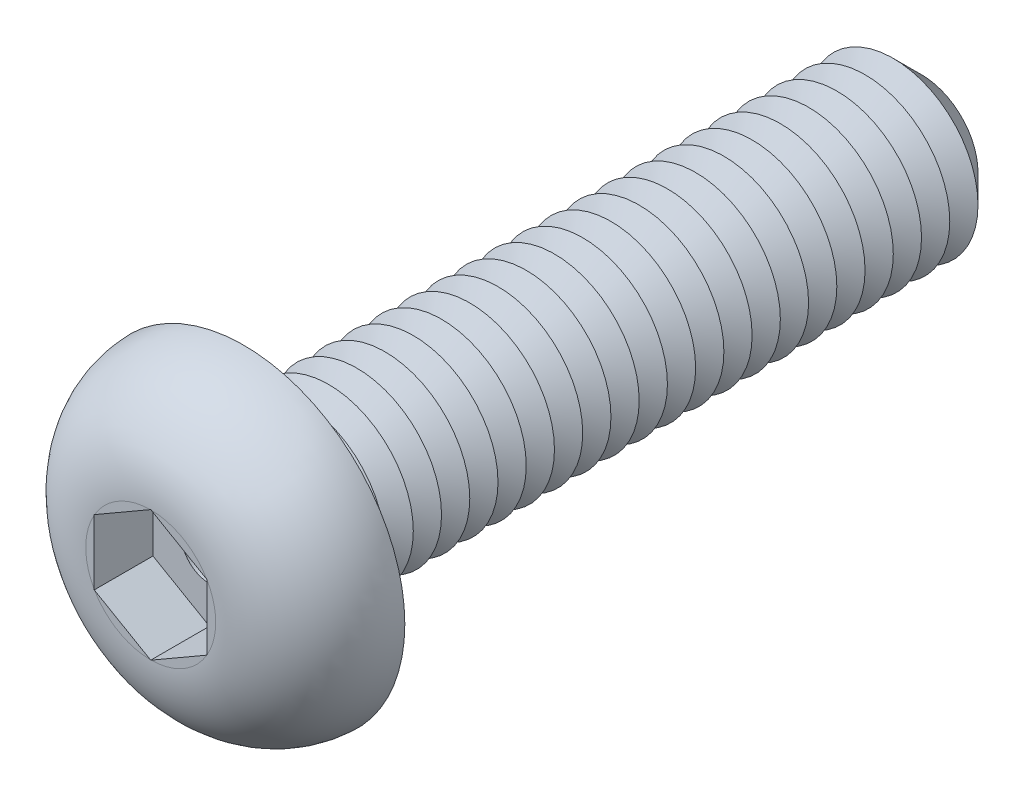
SolidWorks part; units mm, degrees
ref_plane "Front Plane" through (0, 0, 0) normal (0, 0, 1) x (1, 0, 0)
ref_plane "Top Plane" through (0, 0, 0) normal (0, 1, 0) x (1, 0, 0)
ref_plane "Right Plane" through (0, 0, 0) normal (1, 0, 0) x (0, 0, -1)
sketch "Sketch1" plane through (0, 0, 0) normal (1, 0, 0) x (0, 0, -1)
  line L0 (-47.9342, 0) -> (60.3146, 0) construction
sketch "Sketch2" plane through (0, 0, 0) normal (1, 0, 0) x (0, 0, -1)
  line L0 (0, 0) -> (-1.65, 0)
  line L1 (-47.9342, 0) -> (60.3146, 0) construction
  line L2 (-1.65, 0) -> (-1.65, 1.1507)
  line L3 (0, 2.85) -> (0, 0)
  arc A0 (-1.65, 1.1507) -> (0, 2.85) centre (0.05, 1.1507) cw
  dimension "D1" = 1.7
  dimension "D2" = 1.65
  dimension "D3" = 2.85
revolve "Revolve1" add sketch "Sketch2" angle 360 about L0
sketch "Sketch3" plane through (0, 0, 1.65) normal (0, 0, 1) x (1, 0, 0)
  line L1 (0, 1.1547) -> (-1, 0.5774)
  line L2 (-1, 0.5774) -> (-1, -0.5774)
  line L3 (-1, -0.5774) -> (0, -1.1547)
  line L4 (0, -1.1547) -> (1, -0.5774)
  line L5 (1, -0.5774) -> (1, 0.5774)
  line L6 (1, 0.5774) -> (0, 1.1547)
  circle A0 centre (0, 0) radius 1 construction
  dimension "D1" = 2
extrude "Cut-Extrude1" cut sketch "Sketch3" against normal blind 1.04
sketch "Sketch4" plane through (0, 0, 0) normal (0, 0, -1) x (-1, 0, 0)
  circle A0 centre (0, 0) radius 1.5
  dimension "D1" = 3
extrude "Boss-Extrude1" add sketch "Sketch4" along normal blind 12
chamfer "Chamfer1" distance 0.5 angle 45 1 edges at (-1.5, 0, -12)
sketch "Sketch5" plane through (0, 0, 0) normal (1, 0, 0) x (0, 0, -1)
  line L0 (0.5, 1.5) -> (1, 1.5)
  line L1 (11.5, 1.5) -> (0, 1.5) construction
  line L2 (1, 1.5) -> (0.75, 1.067)
  line L3 (0.75, 1.067) -> (0.5, 1.5)
  line L4 (0, -2.85) -> (0, 2.85) construction
  line L5 (11.5, 1.5) -> (0, 1.5) construction
  dimension "D1" = 0.5
  dimension "D2" = 0.5
revolve "Cut-Revolve1" cut sketch "Sketch5" angle 360 about L0
pattern_linear "LPattern1" count 22 spacing 0.5 along (0, 0, -1) of "Cut-Revolve1"
fillet "Fillet2" radius 0.25 1 edges at (1.5, 0, 0)
sketch "Sketch6" plane through (0, 0, 0.61) normal (0, 0, 1) x (1, 0, 0)
  circle A0 centre (0, 0) radius 0.5
  dimension "D1" = 1
extrude "Cut-Extrude2" cut sketch "Sketch6" against normal up to surface (12.61 mm away)
